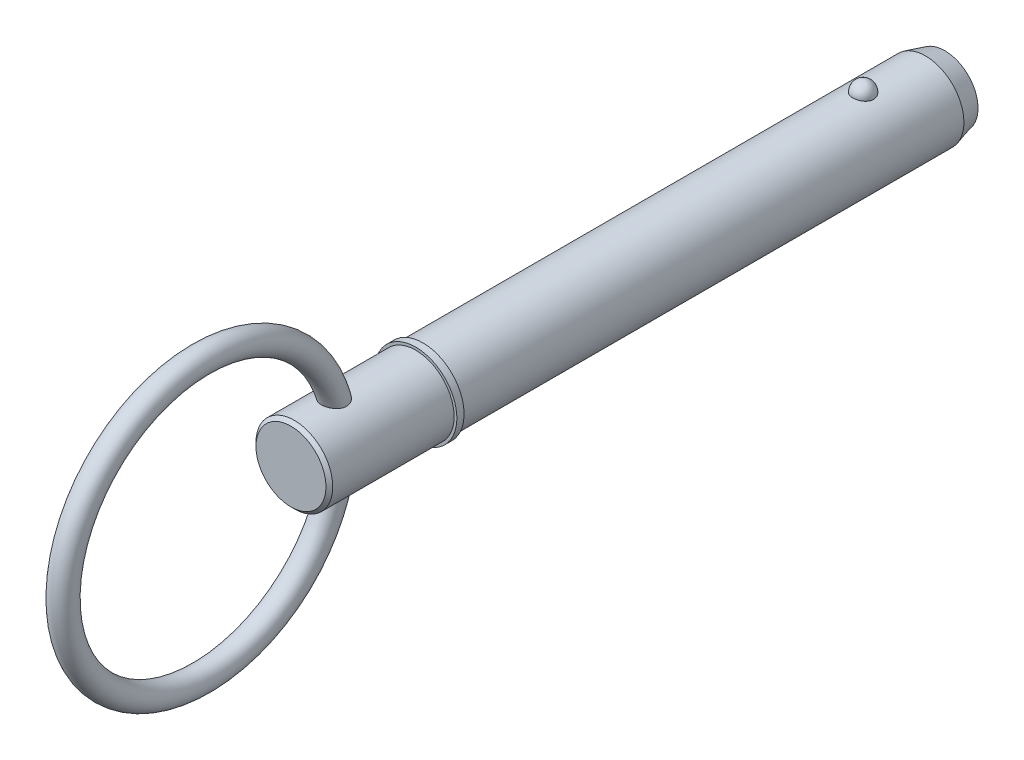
SolidWorks part; units mm, degrees
ref_plane "Front Plane" through (0, 0, 0) normal (0, 0, 1) x (1, 0, 0)
ref_plane "Top Plane" through (0, 0, 0) normal (0, 1, 0) x (1, 0, 0)
ref_plane "Right Plane" through (0, 0, 0) normal (1, 0, 0) x (0, 0, -1)
sketch "Sketch2" plane through (0, 0, 0) normal (0, 0, 1) x (1, 0, 0)
  circle A0 centre (0, 0) radius 7.94
  point P3 (0, 7.94)
  dimension "D1" = 15.88
extrude "Boss-Extrude1" add sketch "Sketch2" along normal blind 88.9
sketch "Sketch3" plane through (0, 0, 0) normal (0, 0, -1) x (-1, 0, 0)
  circle A0 centre (0, 0) radius 7.94
  dimension "D1" = 15.88
extrude "Boss-Extrude2" add sketch "Sketch3" along normal blind 19.05
chamfer "Chamfer1" distance 4 angle 15 1 edges at (-7.94, 0, -19.05)
sketch "Sketch18" plane through (0, 0, 0) normal (1, 0, 0) x (0, 0, -1)
  line L0 (15.05, 7.94) -> (-88.9, 7.94) construction
  line L1 (2.15, 10.09) -> (2.15, 5.79)
  line L2 (-88.9, -7.94) -> (15.05, -7.94) construction
  arc A0 (2.15, 10.09) -> (2.15, 5.79) centre (2.15, 7.94) ccw
  point P4 (0, 7.94)
  dimension "D1" = 18.03
revolve "Revolve1" add sketch "Sketch18" angle 360 about L1
sketch "Sketch19" plane through (0, 0, 0) normal (1, 0, 0) x (0, 0, -1)
  line L0 (-33.7288, 0) -> (-46.4542, 0) construction
sketch "Sketch20" plane through (0, 0, 0) normal (1, 0, 0) x (0, 0, -1)
  line L0 (-88.9, 0) -> (-88.9, 8.5)
  line L1 (-88.9, 7.94) -> (-88.9, -7.94) construction
  line L2 (-88.9, 8.5) -> (-90.4, 8.5)
  line L3 (-90.4, 8.5) -> (-90.4, 0)
  line L4 (-33.7288, 0) -> (-46.4542, 0) construction
  line L5 (-90.4, 0) -> (-88.9, 0)
  dimension "D1" = 8.5
  dimension "D2" = 1.5
revolve "Revolve2" add sketch "Sketch20" angle 360 about L0
sketch "Sketch21" plane through (0, 0, 88.9) normal (0, 0, -1) x (-1, 0, 0)
  circle A0 centre (0, 0) radius 7.94
  dimension "D1" = 15.88
extrude "Boss-Extrude3" add sketch "Sketch21" against normal blind 27.31
chamfer "Chamfer2" distance 0.7 angle 45 1 edges at (-7.94, 0, 116.21)
sketch "Sketch23" plane through (0, 0, 0) normal (1, 0, 0) x (0, 0, -1)
  line L0 (-116.21, 7.24) -> (-116.21, -7.24) construction
  circle A0 centre (-134.785, 0) radius 28.575
  point P2 (-106.21, 0)
  dimension "D1" = 57.15
  dimension "D2" = 10
sketch "Sketch24" plane through (0, 0, 0) normal (0, 1, 0) x (1, 0, 0)
  circle A0 centre (0, -106.21) radius 2.5
  dimension "D1" = 5
sweep "Sweep1" add profiles "Sketch24" path "Sketch23"
